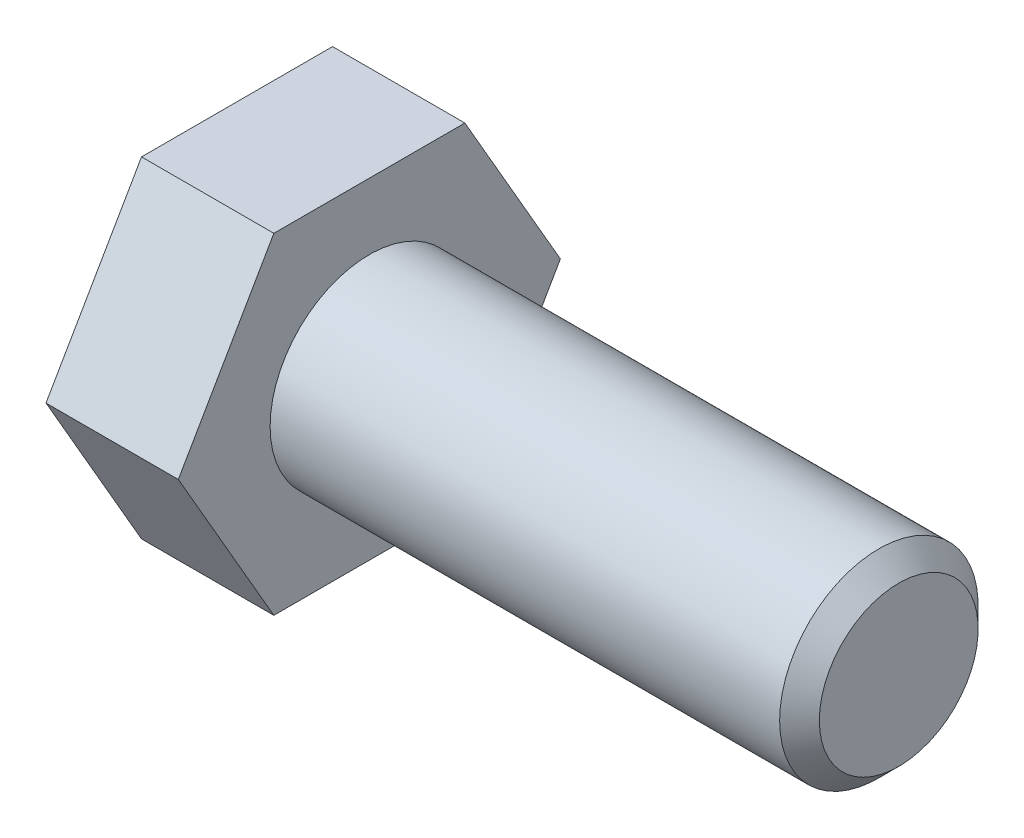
SolidWorks part; units mm, degrees
ref_plane "Vorne" through (0, 0, 0) normal (0, 0, 1) x (1, 0, 0)
ref_plane "Oben" through (0, 0, 0) normal (0, 1, 0) x (1, 0, 0)
ref_plane "Rechts" through (0, 0, 0) normal (1, 0, 0) x (0, 0, -1)
sketch "Skizze1" plane through (0, 0, 0) normal (0, 0, 1) x (1, 0, 0)
  line L0 (0, 0) -> (119.8775, 0) construction
  line L1 (10, 0) -> (10, 1.5)
  line L2 (10, 1.5) -> (2, 1.5)
  line L3 (2, 1.5) -> (2, 3.5)
  line L4 (2, 3.5) -> (0, 3.5)
  line L5 (0, 3.5) -> (0, 0)
  line L6 (0, 0) -> (10, 0)
  dimension "D1" = 8
  dimension "D2" = 3
  dimension "D3" = 2
  dimension "D4" = 7
revolve "Rotation1" add sketch "Skizze1" angle 360 about L0
sketch "Skizze2" plane through (0, 0, 0) normal (-1, 0, 0) x (0, 0, 1)
  line L1 (1.4434, 2.5) -> (-1.4434, 2.5)
  line L2 (-1.4434, 2.5) -> (-2.8868, 0)
  line L3 (-2.8868, 0) -> (-1.4434, -2.5)
  line L4 (-1.4434, -2.5) -> (1.4434, -2.5)
  line L5 (1.4434, -2.5) -> (2.8868, 0)
  line L6 (2.8868, 0) -> (1.4434, 2.5)
  circle A0 centre (0, 0) radius 2.5 construction
  dimension "D1" = 5
extrude "Schnitt-Linear austragen1" cut sketch "Skizze2" against normal through all flip side to cut
chamfer "Fase1" distance 0.3 angle 45 1 edges at (10, 0, 1.5)
